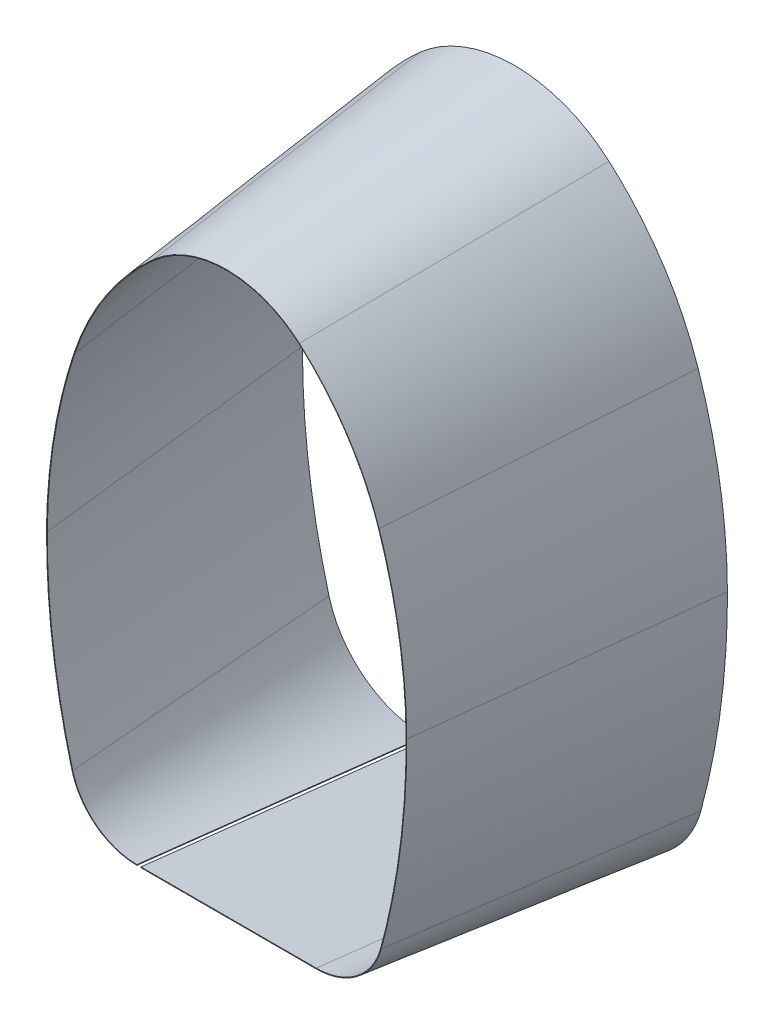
SolidWorks part; units mm, degrees
ref_plane "Vorne" through (0, 0, 0) normal (0, 0, 1) x (1, 0, 0)
ref_plane "Oben" through (0, 0, 0) normal (0, 1, 0) x (1, 0, 0)
ref_plane "Rechts" through (0, 0, 0) normal (1, 0, 0) x (0, 0, -1)
ref_plane "Ebene1" through (0, 0, 3) normal (0, 0, 1) x (1, 0, 0)
ref_plane "Ebene2" through (0, 0, -41.12) normal (0, 0, 1) x (1, 0, 0)
sketch "Skizze1" plane through (0, 0, 3) normal (0, 0, 1) x (1, 0, 0)
  line L2 (-13.1496, -37.3544) -> (13.7278, -37.3544)
  arc A18 (-23.5963, -29.7994) -> (-13.7496, -37.3544) centre (-13.7278, -27.1318) ccw
  arc A19 (-27.4897, -0.043) -> (-23.5963, -29.7994) centre (84.9043, -0.47) ccw
  arc A20 (-23.2681, 25.7472) -> (-27.4897, -0.043) centre (55.3216, -0.3576) ccw
  arc A21 (-11.0854, 44.1886) -> (-23.2681, 25.7472) centre (17.0571, 12.3526) ccw
  arc A22 (11.0854, 44.1886) -> (-11.0854, 44.1886) centre (0, 31.6483) ccw
  arc A23 (23.2681, 25.7472) -> (11.0854, 44.1886) centre (-17.0571, 12.3526) ccw
  arc A24 (27.4897, -0.043) -> (23.2681, 25.7472) centre (-55.3216, -0.3576) ccw
  arc A25 (23.5963, -29.7994) -> (27.4897, -0.043) centre (-84.9043, -0.47) ccw
  arc A26 (13.7278, -37.3544) -> (23.5963, -29.7994) centre (13.7278, -27.1318) ccw
sketch "Skizze2" plane through (0, 0, -41.12) normal (0, 0, 1) x (1, 0, 0)
  line L0 (-13.7604, -42.3784) -> (-13.1496, -42.3784) construction
  line L1 (13.728, -42.3784) -> (-13.1496, -42.3784)
  arc A1 (13.728, -42.3784) -> (28.4463, -31.1106) centre (13.728, -27.1318) ccw
  spline S8 degree 3 poles (32.5142, -0.0237) (32.534, -5.2646) (32.2025, -10.5068) (30.8424, -20.9002) (29.814, -26.0512) (28.4463, -31.1106) knots 0 0 0 0 0.5 0.5 1 1 1 1
  spline S9 degree 3 poles (28.0365, 27.3306) (29.4989, 22.928) (30.6117, 18.4094) (32.1106, 9.253) (32.4965, 4.6154) (32.5142, -0.0237) knots 0 0 0 0 0.5 0.5 1 1 1 1
  spline S10 degree 3 poles (14.4129, 47.952) (17.5351, 45.1921) (20.2919, 42.0194) (24.886, 35.0657) (26.7228, 31.2852) (28.0365, 27.3306) knots 0 0 0 0 0.5 0.5 1 1 1 1
  spline S11 degree 3 poles (-14.4129, 47.9526) (-12.4457, 49.6915) (-10.161, 51.07) (-5.2502, 52.9293) (-2.6254, 53.4095) (2.6256, 53.4094) (5.2504, 52.9291) (10.1612, 51.0696) (12.4458, 49.6909) (14.4129, 47.952) knots 0 0 0 0 0.25 0.25 0.5 0.5 0.75 0.75 1 1 1 1
  spline S12 degree 3 poles (-28.0359, 27.3309) (-26.7223, 31.2855) (-24.8856, 35.0661) (-20.2918, 42.0199) (-17.535, 45.1927) (-14.4129, 47.9526) knots 0 0 0 0 0.5 0.5 1 1 1 1
  spline S13 degree 3 poles (-32.5135, -0.0234) (-32.4959, 4.6157) (-32.1099, 9.2533) (-30.6111, 18.4097) (-29.4983, 22.9283) (-28.0359, 27.3309) knots 0 0 0 0 0.5 0.5 1 1 1 1
  spline S14 degree 3 poles (-28.4461, -31.1104) (-29.8137, -26.051) (-30.8421, -20.8999) (-32.202, -10.5066) (-32.5335, -5.2643) (-32.5135, -0.0234) knots 0 0 0 0 0.5 0.5 1 1 1 1
  spline S15 degree 3 poles (-13.7604, -42.3784) (-15.418, -42.3748) (-17.0748, -42.0986) (-20.2129, -41.0296) (-21.6938, -40.2371) (-24.324, -38.219) (-25.4729, -36.9938) (-27.3178, -34.2393) (-28.0136, -32.7106) (-28.4461, -31.1104) knots 0 0 0 0 0.25 0.25 0.5 0.5 0.75 0.75 1 1 1 1
sheet metal parameters "Blech1" thickness 0.1 parameters "D1"=3.175, "Dicke"=0.1
lofted bend "Ausgeformte Biegungen1" parameters "D1"=0, "D12"=0.1
other "Freiform-Biegung1" parameters "D1"=1000, "D4"=57.296, "D5"=1
other "Freiform-Biegung2" parameters "D1"=1000, "D4"=57.296, "D5"=2
other "Freiform-Biegung3" parameters "D1"=1000, "D4"=57.296, "D5"=3
other "Freiform-Biegung4" parameters "D1"=1000, "D4"=57.296, "D5"=4
other "Freiform-Biegung5" parameters "D1"=1000, "D4"=57.296, "D5"=5
other "Freiform-Biegung6" parameters "D1"=1000, "D4"=57.296, "D5"=6
other "Freiform-Biegung7" parameters "D1"=1000, "D4"=57.296, "D5"=7
other "Freiform-Biegung8" parameters "D1"=1000, "D4"=57.296, "D5"=8
other "Freiform-Biegung9" parameters "D1"=1000, "D4"=57.296, "D5"=9
flat pattern "Abwicklung1"
sketch "Biegung-Linien1" plane through (0, -37.2135, 4.2375) normal (0, 0.9936, -0.1131) x (-1, 0, 0)
  line L0 (-219.2323, 24.7104) -> (-195.5338, 62.263) construction
  line L1 (-220.5013, 25.5268) -> (-196.5756, 62.9346) construction
  line L2 (-221.7951, 26.373) -> (-197.5806, 63.5945) construction
  line L3 (-223.1079, 27.251) -> (-198.55, 64.2508) construction
  line L4 (-224.4357, 28.1668) -> (-199.4883, 64.9049) construction
  line L5 (-225.7779, 29.1146) -> (-200.3997, 65.5588) construction
  line L6 (-227.131, 30.0936) -> (-201.2879, 66.2139) construction
  line L7 (-228.4906, 31.1067) -> (-202.1568, 66.87) construction
  line L8 (-229.8535, 32.1491) -> (-203.0092, 67.5283) construction
  line L9 (-231.2151, 33.2177) -> (-203.8472, 68.1904) construction
  line L10 (-232.5717, 34.3107) -> (-204.6721, 68.8579) construction
  line L11 (-233.9188, 35.4248) -> (-205.4854, 69.5326) construction
  line L12 (-235.2495, 36.5547) -> (-206.2868, 70.2144) construction
  line L13 (-192.381, 8.3288) -> (-169.8315, 46.5823) construction
  line L14 (-196.2261, 10.6125) -> (-173.5488, 48.7902) construction
  line L15 (-200.0222, 12.8812) -> (-177.3052, 51.0352) construction
  line L16 (-203.7957, 15.1562) -> (-181.0662, 53.304) construction
  line L17 (-207.5706, 17.4606) -> (-184.795, 55.5835) construction
  line L18 (-211.3795, 19.8068) -> (-188.4664, 57.8471) construction
  line L19 (-215.2543, 22.2141) -> (-192.0535, 60.0775) construction
  line L20 (-219.2323, 24.7104) -> (-195.5338, 62.263) construction
  line L21 (-168.1443, -5.3791) -> (-146.98, 33.6579) construction
  line L22 (-171.054, -3.7885) -> (-148.9404, 34.7276) construction
  line L23 (-173.7678, -2.2948) -> (-150.8412, 35.7716) construction
  line L24 (-176.2895, -0.8965) -> (-152.6812, 36.7886) construction
  line L25 (-178.6221, 0.4076) -> (-154.4594, 37.7776) construction
  line L26 (-180.7681, 1.618) -> (-156.1754, 38.7377) construction
  line L27 (-182.7303, 2.7337) -> (-157.8285, 39.6679) construction
  line L28 (-184.5114, 3.7532) -> (-159.4183, 40.5675) construction
  line L29 (-186.1131, 4.6753) -> (-160.9444, 41.4357) construction
  line L30 (-187.5368, 5.4989) -> (-162.4067, 42.2718) construction
  line L31 (-188.7835, 6.2233) -> (-163.8048, 43.0752) construction
  line L32 (-189.8539, 6.8474) -> (-165.1387, 43.8452) construction
  line L33 (-190.7487, 7.3707) -> (-166.4084, 44.5814) construction
  line L34 (-191.468, 7.7923) -> (-167.6137, 45.2833) construction
  line L35 (-192.012, 8.1118) -> (-168.7546, 45.9504) construction
  line L36 (-192.381, 8.3288) -> (-169.8315, 46.5823) construction
  line L37 (-145.8067, -16.6427) -> (-127.0022, 23.5842) construction
  line L38 (-148.7234, -15.2595) -> (-129.4465, 24.7414) construction
  line L39 (-151.5938, -13.8833) -> (-131.9217, 25.9271) construction
  line L40 (-154.4177, -12.4948) -> (-134.4157, 27.1503) construction
  line L41 (-157.2082, -11.1018) -> (-136.926, 28.4017) construction
  line L42 (-159.9711, -9.6991) -> (-139.4458, 29.6794) construction
  line L43 (-162.71, -8.2778) -> (-141.9655, 30.9852) construction
  line L44 (-165.4325, -6.8379) -> (-144.4794, 32.3135) construction
  line L45 (-168.1443, -5.3791) -> (-146.98, 33.6579) construction
  line L46 (-116.2522, -27.6115) -> (-104.2581, 15.143) construction
  line L47 (-118.5225, -26.9533) -> (-106.1007, 15.6797) construction
  line L48 (-120.8186, -26.2688) -> (-107.9149, 16.2239) construction
  line L49 (-123.1284, -25.5457) -> (-109.7025, 16.7826) construction
  line L50 (-125.4476, -24.7827) -> (-111.466, 17.3621) construction
  line L51 (-127.7733, -23.9884) -> (-113.2113, 17.9598) construction
  line L52 (-130.0964, -23.1605) -> (-114.9422, 18.579) construction
  line L53 (-132.4091, -22.297) -> (-116.6618, 19.2223) construction
  line L54 (-134.7106, -21.4109) -> (-118.3759, 19.886) construction
  line L55 (-136.9911, -20.495) -> (-120.0886, 20.5712) construction
  line L56 (-139.245, -19.5569) -> (-121.8039, 21.2807) construction
  line L57 (-141.4688, -18.6015) -> (-123.5258, 22.0173) construction
  line L58 (-143.6586, -17.6293) -> (-125.2578, 22.7841) construction
  line L59 (-145.8067, -16.6427) -> (-127.0022, 23.5842) construction
  line L60 (-91.975, -33.6492) -> (-82.5455, 9.7432) construction
  line L61 (-94.9805, -32.9792) -> (-85.3165, 10.3617) construction
  line L62 (-97.9838, -32.2972) -> (-88.089, 10.9919) construction
  line L63 (-100.9864, -31.5858) -> (-90.8497, 11.6495) construction
  line L64 (-103.9966, -30.8513) -> (-93.5943, 12.3196) construction
  line L65 (-107.0219, -30.093) -> (-96.3145, 13.0034) construction
  line L66 (-110.0672, -29.3) -> (-99.0022, 13.7053) construction
  line L67 (-113.1412, -28.4729) -> (-101.6521, 14.4201) construction
  line L68 (-116.2522, -27.6115) -> (-104.2581, 15.143) construction
  line L69 (-64.664, -39.0735) -> (-56.7954, 4.6289) construction
  line L70 (-68.1383, -38.4353) -> (-59.431, 5.1115) construction
  line L71 (-71.3812, -37.8298) -> (-61.9602, 5.582) construction
  line L72 (-74.3941, -37.2566) -> (-64.3809, 6.0394) construction
  line L73 (-77.1781, -36.715) -> (-66.6924, 6.4833) construction
  line L74 (-79.7337, -36.2055) -> (-68.8939, 6.913) construction
  line L75 (-82.0623, -35.7336) -> (-70.9851, 7.328) construction
  line L76 (-84.1639, -35.302) -> (-72.9656, 7.7281) construction
  line L77 (-86.0383, -34.9124) -> (-74.8358, 8.1116) construction
  line L78 (-87.6846, -34.5665) -> (-76.5958, 8.4773) construction
  line L79 (-89.1023, -34.266) -> (-78.2464, 8.8241) construction
  line L80 (-90.2908, -34.0121) -> (-79.788, 9.1512) construction
  line L81 (-91.2488, -33.8061) -> (-81.2205, 9.4576) construction
  line L82 (-91.975, -33.6492) -> (-82.5455, 9.7432) construction
  line L83 (-33.627, -44.1772) -> (-27.0866, -0.2564) construction
  line L84 (-38.27, -43.4697) -> (-31.1491, 0.3629) construction
  line L85 (-42.7777, -42.7698) -> (-35.3226, 1.0126) construction
  line L86 (-47.1955, -42.0657) -> (-39.582, 1.6906) construction
  line L87 (-51.559, -41.3447) -> (-43.8956, 2.394) construction
  line L88 (-55.9033, -40.6098) -> (-48.2272, 3.1224) construction
  line L89 (-60.2604, -39.8556) -> (-52.5392, 3.871) construction
  line L90 (-64.664, -39.0735) -> (-56.7954, 4.6289) construction
  line L91 (-13.728, -45.6506) -> (-13.7278, -1.2455) construction
  line L92 (-15.4764, -45.6331) -> (-14.7816, -1.2351) construction
  line L93 (-17.227, -45.6008) -> (-15.8399, -1.2151) construction
  line L94 (-18.9711, -45.5483) -> (-16.9022, -1.1846) construction
  line L95 (-20.703, -45.471) -> (-17.9712, -1.1426) construction
  line L96 (-22.4187, -45.3707) -> (-19.0486, -1.0878) construction
  line L97 (-24.1127, -45.2497) -> (-20.137, -1.0187) construction
  line L98 (-25.7798, -45.1104) -> (-21.2393, -0.9339) construction
  line L99 (-27.4181, -44.9538) -> (-22.3583, -0.8334) construction
  line L100 (-29.0245, -44.781) -> (-23.4978, -0.7166) construction
  line L101 (-30.5954, -44.5932) -> (-24.6627, -0.5823) construction
  line L102 (-32.1307, -44.3915) -> (-25.8573, -0.4295) construction
  line L103 (-33.627, -44.1772) -> (-27.0866, -0.2564) construction
other "Abwickeln-<Freiform-Biegung1>1"
other "Abwickeln-<Freiform-Biegung2>1"
other "Abwickeln-<Freiform-Biegung3>1"
other "Abwickeln-<Freiform-Biegung4>1"
other "Abwickeln-<Freiform-Biegung5>1"
other "Abwickeln-<Freiform-Biegung6>1"
other "Abwickeln-<Freiform-Biegung7>1"
other "Abwickeln-<Freiform-Biegung8>1"
other "Abwickeln-<Freiform-Biegung9>1"
